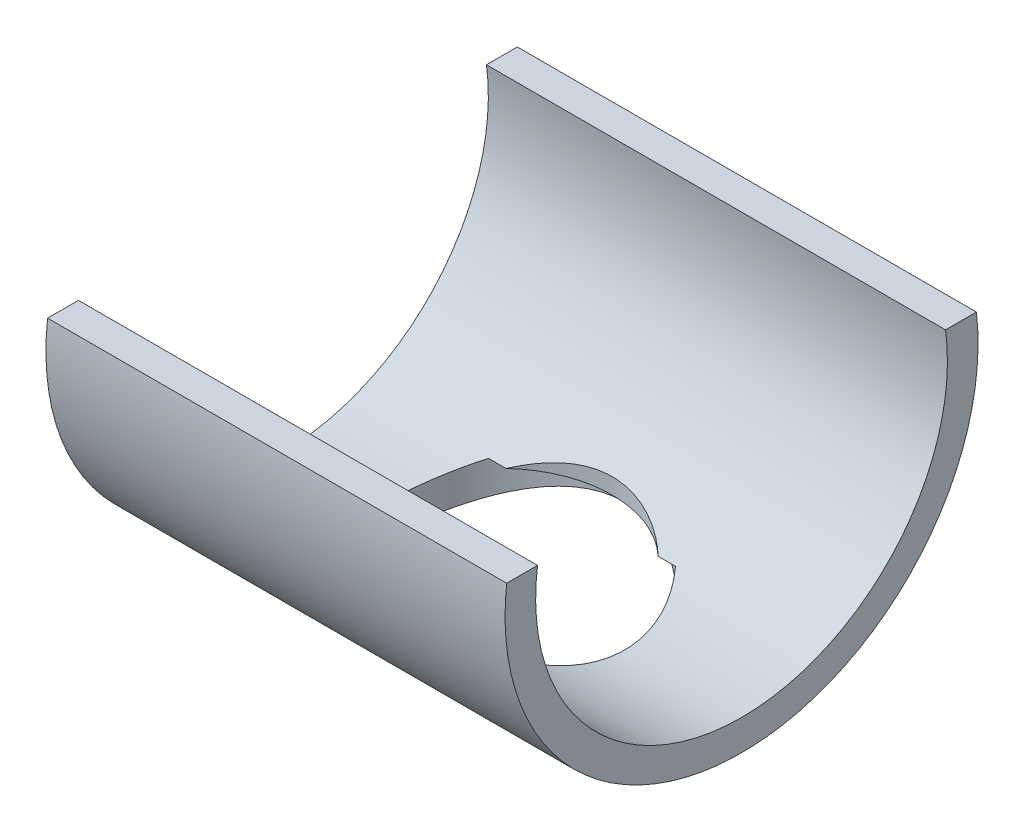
SolidWorks part; units mm, degrees
ref_plane "Face" through (0, 0, 0) normal (0, 0, 1) x (1, 0, 0)
ref_plane "Dessus" through (0, 0, 0) normal (0, 1, 0) x (1, 0, 0)
ref_plane "Droite" through (0, 0, 0) normal (1, 0, 0) x (0, 0, -1)
sketch "Esquisse1" plane through (0, 0, 0) normal (1, 0, 0) x (0, 0, -1)
  line L0 (-84.4097, 10) -> (-73.3212, 10)
  line L1 (73.3212, 10) -> (84.4097, 10)
  arc A0 (-73.3212, 10) -> (73.3212, 10) centre (0, 0) ccw
  arc A1 (-84.4097, 10) -> (84.4097, 10) centre (0, 0) ccw
  dimension "D1" = 85
  dimension "D2" = 74
  dimension "D3" = 10
extrude "Demi coquille" add sketch "Esquisse1" along normal blind 86.5 and the other way blind 78.5
sketch "Esquisse3" plane through (0, 0, 0) normal (0, 0, 1) x (1, 0, 0)
  line L0 (0, -107.7412) -> (0, 37.7509) construction
  line L1 (0, -85) -> (-44.5, -85)
  line L2 (-78.5, -85) -> (86.5, -85) construction
  line L3 (-44.5, -85) -> (-44.5, -68)
  line L4 (-44.5, -68) -> (-40, -68)
  line L5 (-40, -68) -> (-40, 10)
  line L6 (-78.5, 10) -> (86.5, 10) construction
  line L7 (-40, 10) -> (0, 10)
  line L8 (0, -85) -> (0, 10)
  dimension "D1" = 89
  dimension "D2" = 80
  dimension "D3" = 17
revolve "MIP tube" cut sketch "Esquisse3" angle 360 about L0
